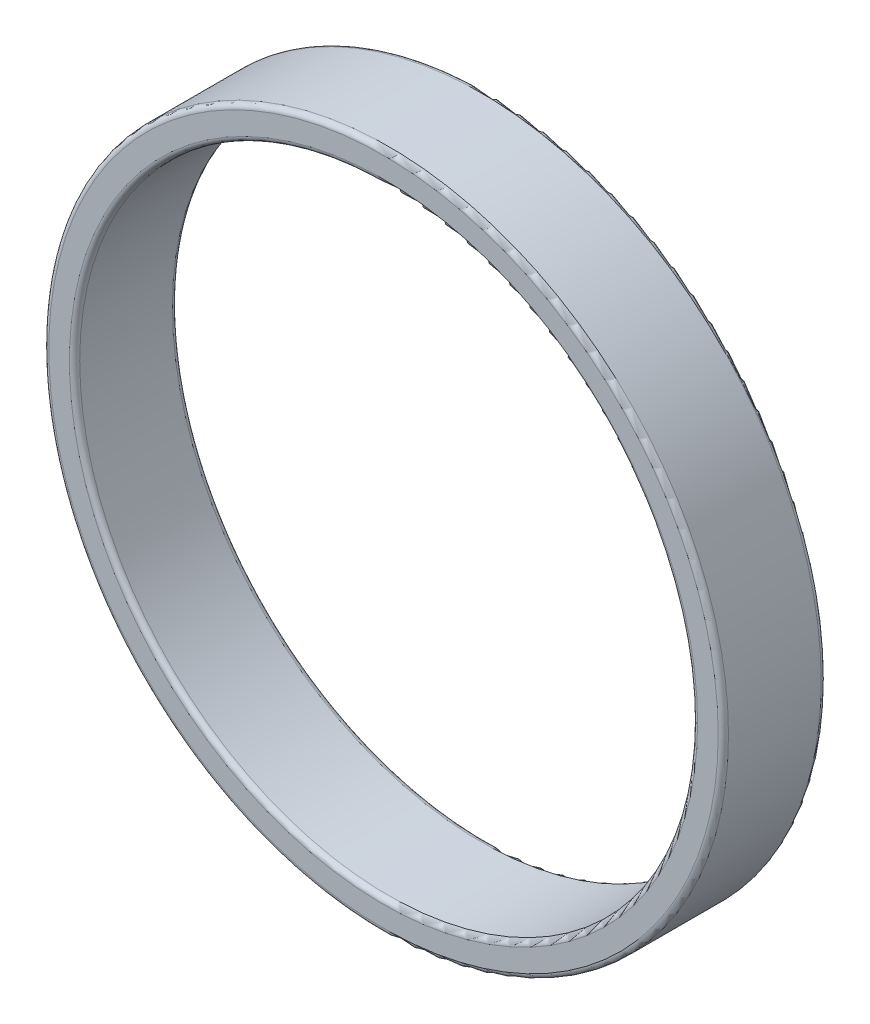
SolidWorks part; units mm, degrees
ref_plane "Front Plane" through (0, 0, 0) normal (0, 0, 1) x (1, 0, 0)
ref_plane "Top Plane" through (0, 0, 0) normal (0, 1, 0) x (1, 0, 0)
ref_plane "Right Plane" through (0, 0, 0) normal (1, 0, 0) x (0, 0, -1)
sketch "Sketch1" plane through (0, 0, 0) normal (0, 0, 1) x (1, 0, 0)
  circle A0 centre (0, 0) radius 41.91
  circle A1 centre (0, 0) radius 38.1
  dimension "D1" = 76.2
  dimension "D2" = 3.81
extrude "Boss-Extrude1" add sketch "Sketch1" along normal mid plane 12.7
fillet "Fillet1" radius 0.635 4 edges at (38.1, 0, -6.35) (38.1, 0, 6.35) (41.91, 0, -6.35) (41.91, 0, 6.35)
